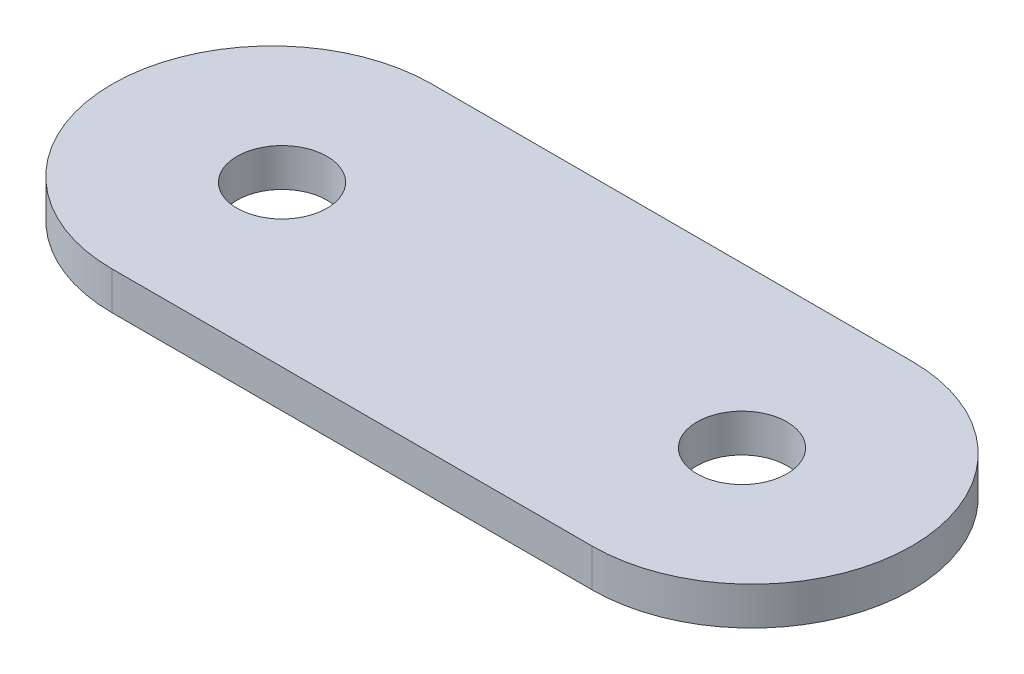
SolidWorks part; units mm, degrees
ref_plane "Front Plane" through (0, 0, 0) normal (0, 0, 1) x (1, 0, 0)
ref_plane "Top Plane" through (0, 0, 0) normal (0, 1, 0) x (1, 0, 0)
ref_plane "Right Plane" through (0, 0, 0) normal (1, 0, 0) x (0, 0, -1)
sketch "Sketch1" plane through (0, 0, 0) normal (0, 1, 0) x (1, 0, 0)
  line L0 (-12, 0) -> (12, 0) construction
  line L1 (-12, 8) -> (12, 8)
  line L2 (-12, -8) -> (12, -8)
  line L3 (-11.5, 0) -> (11.5, 0) construction
  arc A0 (-12, 8) -> (-12, -8) centre (-12, 0) ccw
  arc A1 (12, -8) -> (12, 8) centre (12, 0) ccw
  circle A2 centre (-11.5, 0) radius 2.25
  circle A3 centre (11.5, 0) radius 2.25
  point P2 (0, 0)
  point P8 (20, 0)
  point P9 (-20, 0)
  point P13 (0, 0)
  dimension "D1" = 40
  dimension "D4" = 4.5
  dimension "D5" = 4.5
  dimension "D2" = 16
  dimension "D3" = 23
extrude "Boss-Extrude1" add sketch "Sketch1" along normal blind 1.9
